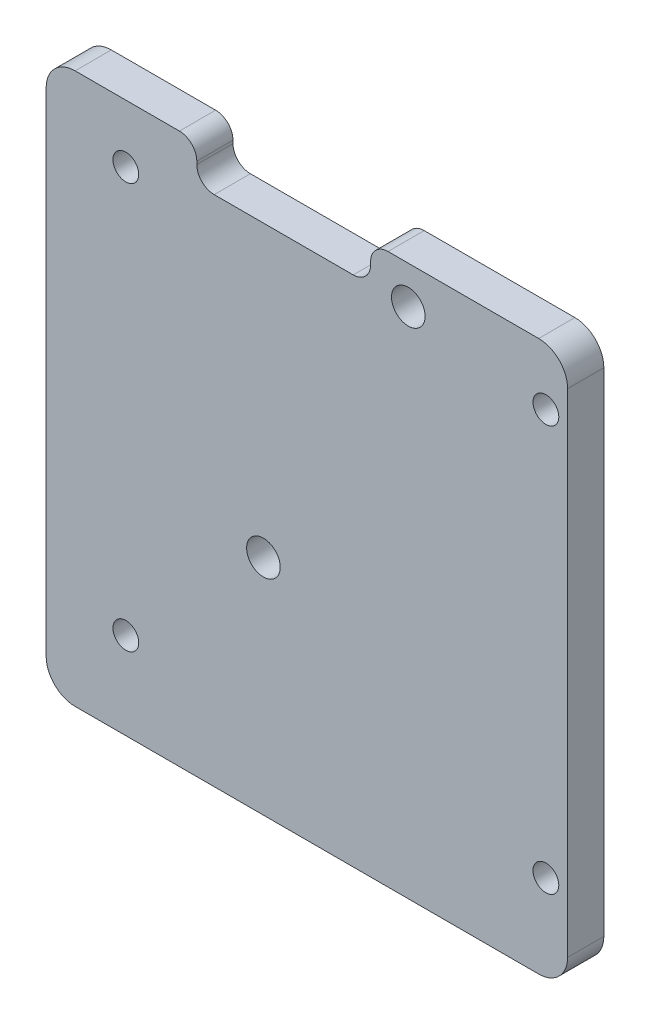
SolidWorks part; units mm, degrees
ref_plane "Front Plane" through (0, 0, 0) normal (0, 0, 1) x (1, 0, 0)
ref_plane "Top Plane" through (0, 0, 0) normal (0, 1, 0) x (1, 0, 0)
ref_plane "Right Plane" through (0, 0, 0) normal (1, 0, 0) x (0, 0, -1)
sketch "Sketch1" plane through (0, 0, 0) normal (0, 0, 1) x (1, 0, 0)
  line L1 (-22.86, 24.13) -> (22.86, 24.13)
  line L2 (-22.86, 24.13) -> (-22.86, -24.13)
  line L3 (-22.86, -24.13) -> (22.86, -24.13)
  line L4 (22.86, 24.13) -> (22.86, -24.13)
  line L5 (-22.86, 24.13) -> (22.86, -24.13) construction
  line L6 (-22.86, -24.13) -> (22.86, 24.13) construction
  point P0 (0, 0)
  dimension "D1" = 45.72
  dimension "D2" = 48.26
extrude "Boss-Extrude1" add sketch "Sketch1" along normal blind 3.175
hole_wizard "#4 Clearance Hole1" positions "Sketch3" profile "Sketch4" hole size "#4" standard "ANSI Inch"
sketch "Sketch3" plane through (0, 0, 3.175) normal (0, 0, 1) x (1, 0, 0)
  line L0 (2.54, 24.13) -> (2.54, -24.13) construction
  line L1 (22.86, 24.13) -> (-22.86, 24.13) construction
  line L2 (-22.86, -24.13) -> (22.86, -24.13) construction
  line L4 (22.86, -24.13) -> (22.86, 24.13) construction
  point P11 (8.89, 20.828)
  point P13 (-3.81, -4.572)
  dimension "D1" = 20.32
  dimension "D2" = 6.35
  dimension "D3" = 3.302
  dimension "D4" = 28.702
  dimension "D5" = 6.35
sketch "Sketch4" plane through (-3.81, -4.572, 3.175) normal (1, 0, 0) x (0, -1, 0)
  line L0 (0, 0) -> (0, 3.175)
  line L1 (0, 3.175) -> (1.4732, 3.175)
  line L2 (1.4732, 3.175) -> (1.4732, 0)
  line L5 (1.4732, 0) -> (0, 0)
  line L11 (0, -6.35) -> (0, 107.95) construction
  dimension "Thru Hole Dia." = 2.9464
  dimension "Thru Hole Depth" = 3.175
sketch "Sketch6" plane through (0, 0, 3.175) normal (0, 0, 1) x (1, 0, 0)
  line L0 (2.54, 24.13) -> (2.54, -24.13) construction
  line L1 (22.86, 24.13) -> (-22.86, 24.13) construction
  line L2 (-22.86, -24.13) -> (22.86, -24.13) construction
  line L3 (22.86, -24.13) -> (22.86, 24.13) construction
  line L5 (5.588, 27.432) -> (-9.652, 27.432)
  line L6 (5.588, 27.432) -> (5.588, 20.828)
  line L7 (5.588, 20.828) -> (-9.652, 20.828)
  line L8 (-9.652, 27.432) -> (-9.652, 20.828)
  line L9 (5.588, 27.432) -> (-9.652, 20.828) construction
  line L10 (5.588, 20.828) -> (-9.652, 27.432) construction
  point P8 (-2.032, 24.13)
  dimension "D1" = 20.32
  dimension "D2" = 4.572
  dimension "D3" = 6.604
  dimension "D4" = 15.24
extrude "Cut-Extrude1" cut sketch "Sketch6" against normal through all
fillet "Fillet1" radius 1.524 4 edges at (5.588, 24.13, 1.5875) (-9.652, 24.13, 1.5875) (-9.652, 20.828, 1.5875) (5.588, 20.828, 1.5875)
hole_wizard "#2 Clearance Hole1" positions "Sketch7" profile "Sketch8" hole size "#2" standard "ANSI Inch"
sketch "Sketch7" plane through (0, 0, 3.175) normal (0, 0, 1) x (1, 0, 0)
  line L0 (20.955, 24.13) -> (20.955, -24.13) construction
  line L1 (22.86, 24.13) -> (7.112, 24.13) construction
  line L2 (-22.86, -24.13) -> (22.86, -24.13) construction
  line L4 (-15.875, 24.13) -> (-15.875, -24.13) construction
  line L5 (-11.176, 24.13) -> (-22.86, 24.13) construction
  line L7 (-22.86, 19.05) -> (22.86, 19.05) construction
  line L8 (-22.86, 24.13) -> (-22.86, -24.13) construction
  line L9 (22.86, -24.13) -> (22.86, 24.13) construction
  line L11 (-22.86, -16.51) -> (22.86, -16.51) construction
  point P26 (-15.875, 19.05)
  point P28 (20.955, 19.05)
  point P30 (-15.875, -16.51)
  point P32 (20.955, -16.51)
  dimension "D1" = 1.905
  dimension "D2" = 5.08
  dimension "D3" = 6.985
  dimension "D4" = 7.62
sketch "Sketch8" plane through (20.955, -16.51, 3.175) normal (1, 0, 0) x (0, -1, 0)
  line L0 (0, 0) -> (0, 3.175)
  line L1 (0, 3.175) -> (1.1303, 3.175)
  line L2 (1.1303, 3.175) -> (1.1303, 0)
  line L5 (1.1303, 0) -> (0, 0)
  line L11 (0, -6.35) -> (0, 107.95) construction
  dimension "Thru Hole Dia." = 2.2606
  dimension "Thru Hole Depth" = 3.175
fillet "Fillet2" radius 2.54 4 edges at (22.86, -24.13, 1.5875) (-22.86, -24.13, 1.5875) (-22.86, 24.13, 1.5875) (22.86, 24.13, 1.5875)
sketch "Sketch11" plane through (0, 0, 3.175) normal (0, 0, 1) x (1, 0, 0)
  line L16 (-20.32, -24.2316) -> (20.32, -24.2316)
  line L17 (22.9616, -21.59) -> (22.9616, 21.59)
  line L18 (20.32, 24.2316) -> (7.112, 24.2316)
  line L19 (5.4864, 22.606) -> (5.4864, 22.352)
  line L20 (4.064, 20.9296) -> (-8.128, 20.9296)
  line L21 (-9.5504, 22.352) -> (-9.5504, 22.606)
  line L22 (-11.176, 24.2316) -> (-20.32, 24.2316)
  line L23 (-22.9616, 21.59) -> (-22.9616, -21.59)
  line L24 (-20.32, -24.2316) -> (20.32, -24.2316)
  line L25 (22.9616, -21.59) -> (22.9616, 21.59)
  line L26 (20.32, 24.2316) -> (7.112, 24.2316)
  line L27 (5.4864, 22.606) -> (5.4864, 22.352)
  line L28 (4.064, 20.9296) -> (-8.128, 20.9296)
  line L29 (-9.5504, 22.352) -> (-9.5504, 22.606)
  line L30 (-11.176, 24.2316) -> (-20.32, 24.2316)
  line L31 (-22.9616, 21.59) -> (-22.9616, -21.59)
  circle A10 centre (-15.875, 19.05) radius 1.0287
  circle A11 centre (-15.875, 19.05) radius 1.0287
  circle A13 centre (8.89, 20.828) radius 1.3716
  circle A14 centre (8.89, 20.828) radius 1.3716
  arc A16 (20.32, -24.2316) -> (22.9616, -21.59) centre (20.32, -21.59) ccw
  arc A17 (22.9616, 21.59) -> (20.32, 24.2316) centre (20.32, 21.59) ccw
  arc A18 (7.112, 24.2316) -> (5.4864, 22.606) centre (7.112, 22.606) ccw
  arc A19 (4.064, 20.9296) -> (5.4864, 22.352) centre (4.064, 22.352) ccw
  arc A20 (-9.5504, 22.352) -> (-8.128, 20.9296) centre (-8.128, 22.352) ccw
  arc A21 (-9.5504, 22.606) -> (-11.176, 24.2316) centre (-11.176, 22.606) ccw
  arc A22 (-20.32, 24.2316) -> (-22.9616, 21.59) centre (-20.32, 21.59) ccw
  arc A23 (-22.9616, -21.59) -> (-20.32, -24.2316) centre (-20.32, -21.59) ccw
  arc A24 (20.32, -24.2316) -> (22.9616, -21.59) centre (20.32, -21.59) ccw
  arc A25 (22.9616, 21.59) -> (20.32, 24.2316) centre (20.32, 21.59) ccw
  arc A26 (7.112, 24.2316) -> (5.4864, 22.606) centre (7.112, 22.606) ccw
  arc A27 (4.064, 20.9296) -> (5.4864, 22.352) centre (4.064, 22.352) ccw
  arc A28 (-9.5504, 22.352) -> (-8.128, 20.9296) centre (-8.128, 22.352) ccw
  arc A29 (-9.5504, 22.606) -> (-11.176, 24.2316) centre (-11.176, 22.606) ccw
  arc A30 (-20.32, 24.2316) -> (-22.9616, 21.59) centre (-20.32, 21.59) ccw
  arc A31 (-22.9616, -21.59) -> (-20.32, -24.2316) centre (-20.32, -21.59) ccw
  circle A32 centre (20.955, 19.05) radius 1.0287
  circle A33 centre (20.955, 19.05) radius 1.0287
  circle A35 centre (-3.81, -4.572) radius 1.3716
  circle A36 centre (-3.81, -4.572) radius 1.3716
  circle A38 centre (-15.875, -16.51) radius 1.0287
  circle A39 centre (-15.875, -16.51) radius 1.0287
  circle A41 centre (20.955, -16.51) radius 1.0287
  circle A42 centre (20.955, -16.51) radius 1.0287
equation "\"t\" = .125in'plywood thickness"
equation "\"kerf\"= .004in'laser cutter kerf"
equation "\"D1@Boss-Extrude1\"=\"t\""
equation "\"D2@Sketch11\"=\"kerf\""
equation "\"D3@Sketch11\"=\"kerf\""
equation "\"D4@Sketch11\"=\"kerf\""
equation "\"D5@Sketch11\"=\"kerf\""
equation "\"D6@Sketch11\"=\"kerf\""
equation "\"D7@Sketch11\"=\"kerf\""
equation "\"D1@Sketch11\"=\"kerf\""
